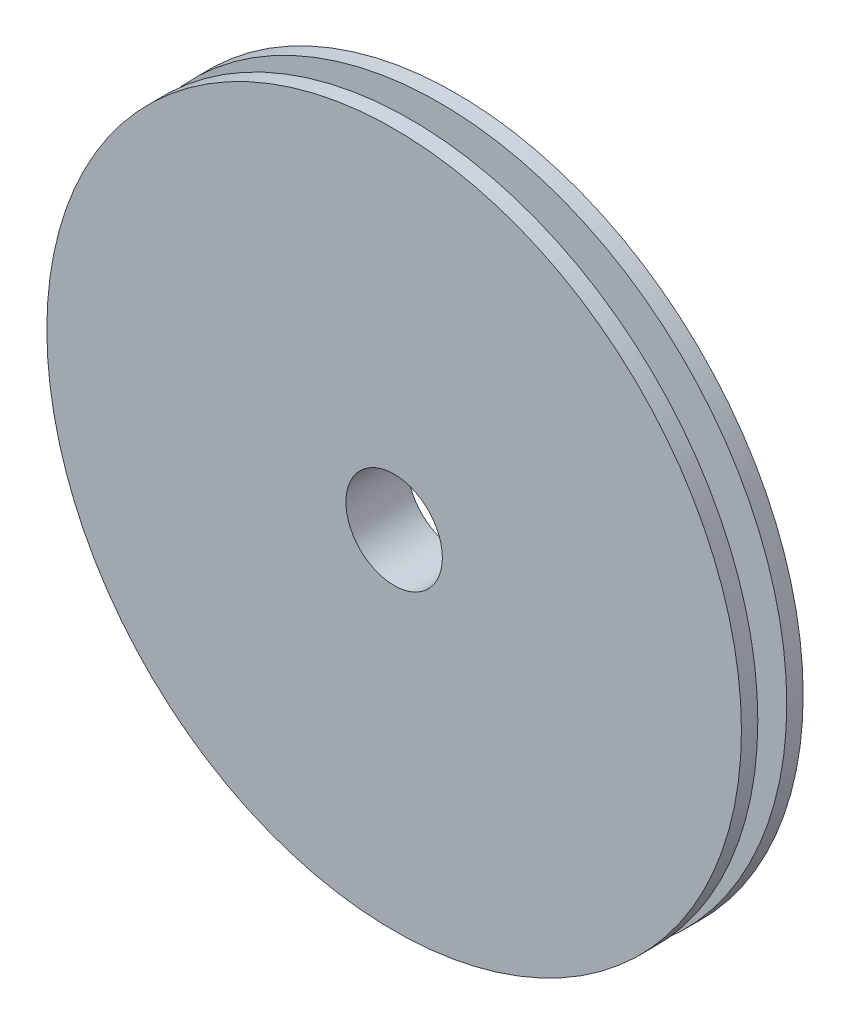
SolidWorks part; units mm, degrees
ref_plane "Front Plane" through (0, 0, 0) normal (0, 0, 1) x (1, 0, 0)
ref_plane "Top Plane" through (0, 0, 0) normal (0, 1, 0) x (1, 0, 0)
ref_plane "Right Plane" through (0, 0, 0) normal (1, 0, 0) x (0, 0, -1)
sketch "Sketch1" plane through (0, 0, 0) normal (0, 0, 1) x (1, 0, 0)
  circle A0 centre (0, 0) radius 18
  dimension "D1" = 36
extrude "Boss-Extrude1" add sketch "Sketch1" along normal blind 3.2
sketch "Sketch2" plane through (0, 0, 3.2) normal (0, 0, 1) x (1, 0, 0)
  circle A0 centre (0, 0) radius 2.5
  dimension "D1" = 5
extrude "Cut-Extrude1" cut sketch "Sketch2" against normal blind 43 and the other way blind 17
ref_plane "Plane1" through (0, 0, 1.6) normal (0, 0, 1) x (1, 0, 0)
sketch "Sketch5" plane through (0, 0, 1.6) normal (0, 0, 1) x (1, 0, 0)
  circle A0 centre (0, 0) radius 18
  circle A1 centre (0, 0) radius 15.5
  dimension "D1" = 2.5
  dimension "D2" = 36
extrude "Cut-Extrude4" cut sketch "Sketch5" against normal mid plane 1.5 contours A0 | A1
